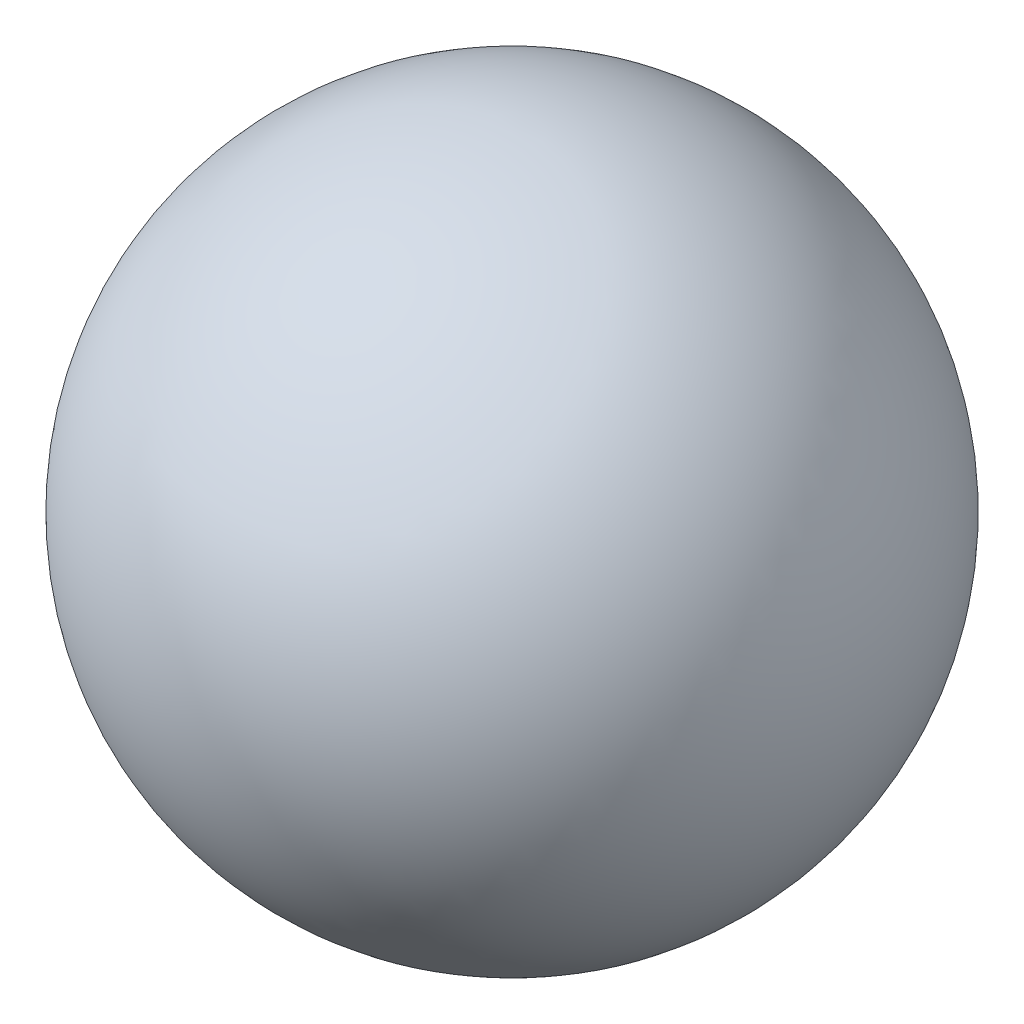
SolidWorks part; units mm, degrees
ref_plane "前视基准面" through (0, 0, 0) normal (0, 0, 1) x (1, 0, 0)
ref_plane "上视基准面" through (0, 0, 0) normal (0, 1, 0) x (1, 0, 0)
ref_plane "右视基准面" through (0, 0, 0) normal (1, 0, 0) x (0, 0, -1)
sketch "草图1" plane through (0, 0, 0) normal (0, 0, 1) x (1, 0, 0)
  line L0 (0, 4.5) -> (0, -4.5)
  line L1 (0, 0) -> (0, -6.3689) construction
  arc A0 (0, 4.5) -> (0, -4.5) centre (0, 0) cw
  dimension "D1" = 4.5
revolve "旋转1" add sketch "草图1" angle 360 about L1
sketch "草图2" plane through (0, 0, 0) normal (0, 0, 1) x (1, 0, 0)
  line L0 (-3.5, -2.8284) -> (3.5, -2.8284)
  circle A0 centre (0, 0) radius 4.5 construction
  arc A1 (-3.5, -2.8284) -> (3.5, -2.8284) centre (0, 0) ccw
  dimension "D1" = 7
ref_plane "基准面2" through (0, -2.8284, 0) normal (0, 1, 0) x (-1, 0, 0)
sketch "草图4" plane through (0, -2.8284, 0) normal (0, 1, 0) x (-1, 0, 0)
  circle A0 centre (0, 0) radius 3.5
  dimension "D1" = 7
